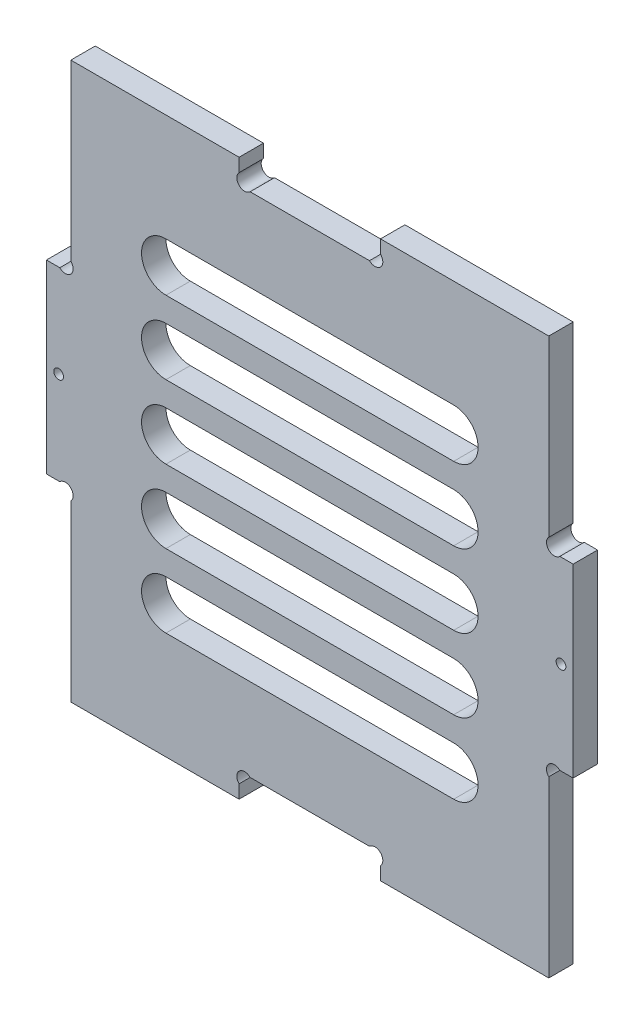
SolidWorks part; units mm, degrees
ref_plane "Plan de face" through (0, 0, 0) normal (0, 0, 1) x (1, 0, 0)
ref_plane "Plan de dessus" through (0, 0, 0) normal (0, 1, 0) x (1, 0, 0)
ref_plane "Plan de droite" through (0, 0, 0) normal (1, 0, 0) x (0, 0, -1)
sketch "Esquisse1" plane through (0, 0, 0) normal (0, 0, 1) x (1, 0, 0)
  line L0 (70.7466, -41.1249) -> (83.6738, -54.0521) construction
  line L1 (36.2466, -74.1249) -> (22.2013, -88.1702) construction
  line L2 (36.2466, -76.3876) -> (36.2466, -79.1249)
  line L3 (36.2466, -79.1249) -> (70.7466, -79.1249)
  line L4 (70.7466, -79.1249) -> (70.7466, -43.3876)
  line L5 (21.7466, -109.3643) -> (21.7466, -12.1078) construction
  line L6 (73.0093, -41.1249) -> (75.7466, -41.1249)
  line L7 (-29.5162, -41.1249) -> (-32.2534, -41.1249)
  line L8 (-27.2534, -79.1249) -> (-27.2534, -43.3876)
  line L9 (7.2466, -79.1249) -> (-27.2534, -79.1249)
  line L10 (7.2466, -76.3876) -> (7.2466, -79.1249)
  line L11 (7.2466, 32.1379) -> (7.2466, 34.8751)
  line L12 (118.8844, -79.1249) -> (8.0382, -79.1249) construction
  line L13 (7.2466, 34.8751) -> (-27.2534, 34.8751)
  line L14 (-27.2534, 34.8751) -> (-27.2534, -0.8621)
  line L15 (-29.5162, -3.1249) -> (-32.2534, -3.1249)
  line L16 (73.0093, -3.1249) -> (75.7466, -3.1249)
  line L17 (70.7466, 34.8751) -> (70.7466, -0.8621)
  line L18 (36.2466, 34.8751) -> (70.7466, 34.8751)
  line L19 (36.2466, 32.1379) -> (36.2466, 34.8751)
  line L20 (9.5093, -74.1249) -> (33.9838, -74.1249)
  line L21 (-32.2534, -41.1249) -> (-32.2534, -3.1249)
  line L22 (9.5093, 29.8751) -> (33.9838, 29.8751)
  line L23 (73.2466, -29.0691) -> (73.2466, -18.6404) construction
  line L24 (75.7466, -3.1249) -> (75.7466, -41.1249)
  line L25 (51.2466, -65.6123) -> (51.2466, -9.4613) construction
  line L26 (-7.7534, -17.1249) -> (51.2466, -17.1249)
  line L27 (-7.7534, -27.1249) -> (51.2466, -27.1249)
  line L28 (-7.7534, -2.1249) -> (51.2466, -2.1249)
  line L29 (-7.7534, -12.1249) -> (51.2466, -12.1249)
  line L30 (-7.7534, 12.8751) -> (51.2466, 12.8751)
  line L31 (-7.7534, 2.8751) -> (51.2466, 2.8751)
  line L32 (-7.7534, -32.1249) -> (51.2466, -32.1249)
  line L33 (99.0418, -74.1249) -> (8.0382, -74.1249) construction
  line L34 (-33.2534, -22.1249) -> (114.0891, -22.1249) construction
  line L35 (75.7466, -109.3643) -> (75.7466, -17.8071) construction
  line L36 (-7.7534, -42.1249) -> (51.2466, -42.1249)
  line L37 (70.7466, -92.1846) -> (70.7466, -17.8071) construction
  line L38 (106.1968, -41.1249) -> (8.0382, -41.1249) construction
  line L39 (36.2466, -99.6083) -> (36.2466, -17.8071) construction
  line L40 (-7.7534, -47.1249) -> (51.2466, -47.1249)
  line L41 (-7.7534, -57.1249) -> (51.2466, -57.1249)
  arc A0 (73.0093, -41.1249) -> (70.7466, -43.3876) centre (71.8779, -42.2562) ccw
  arc A1 (36.2466, -76.3876) -> (33.9838, -74.1249) centre (35.1152, -75.2562) ccw
  arc A2 (-29.5162, -41.1249) -> (-27.2534, -43.3876) centre (-28.3848, -42.2562) cw
  arc A3 (7.2466, -76.3876) -> (9.5093, -74.1249) centre (8.3779, -75.2562) cw
  arc A4 (7.2466, 32.1379) -> (9.5093, 29.8751) centre (8.3779, 31.0065) ccw
  arc A5 (-29.5162, -3.1249) -> (-27.2534, -0.8621) centre (-28.3848, -1.9935) ccw
  arc A6 (73.0093, -3.1249) -> (70.7466, -0.8621) centre (71.8779, -1.9935) cw
  arc A7 (36.2466, 32.1379) -> (33.9838, 29.8751) centre (35.1152, 31.0065) cw
  arc A8 (51.2466, -27.1249) -> (51.2466, -17.1249) centre (51.2466, -22.1249) ccw
  arc A9 (-7.7534, -27.1249) -> (-7.7534, -17.1249) centre (-7.7534, -22.1249) cw
  arc A10 (51.2466, -12.1249) -> (51.2466, -2.1249) centre (51.2466, -7.1249) ccw
  arc A11 (-7.7534, -12.1249) -> (-7.7534, -2.1249) centre (-7.7534, -7.1249) cw
  arc A12 (51.2466, 2.8751) -> (51.2466, 12.8751) centre (51.2466, 7.8751) ccw
  arc A13 (-7.7534, 2.8751) -> (-7.7534, 12.8751) centre (-7.7534, 7.8751) cw
  arc A14 (51.2466, -42.1249) -> (51.2466, -32.1249) centre (51.2466, -37.1249) ccw
  arc A15 (-7.7534, -42.1249) -> (-7.7534, -32.1249) centre (-7.7534, -37.1249) cw
  arc A16 (51.2466, -57.1249) -> (51.2466, -47.1249) centre (51.2466, -52.1249) ccw
  arc A17 (-7.7534, -57.1249) -> (-7.7534, -47.1249) centre (-7.7534, -52.1249) cw
  circle A18 centre (73.2466, -22.1249) radius 1
  circle A19 centre (-29.7534, -22.1249) radius 1
  dimension "D5" = 19.5
  dimension "D2" = 45
  dimension "D6" = 5
  dimension "D4" = 45
  dimension "D8" = 3
  dimension "D3" = 57
  dimension "D7" = 38
  dimension "D9" = 54
  dimension "D10" = 39.5
  dimension "D11" = 5
  dimension "D13" = 2.5
  dimension "D12" = 3
extrude "Boss.-Extru.1" add sketch "Esquisse1" along normal blind 5
